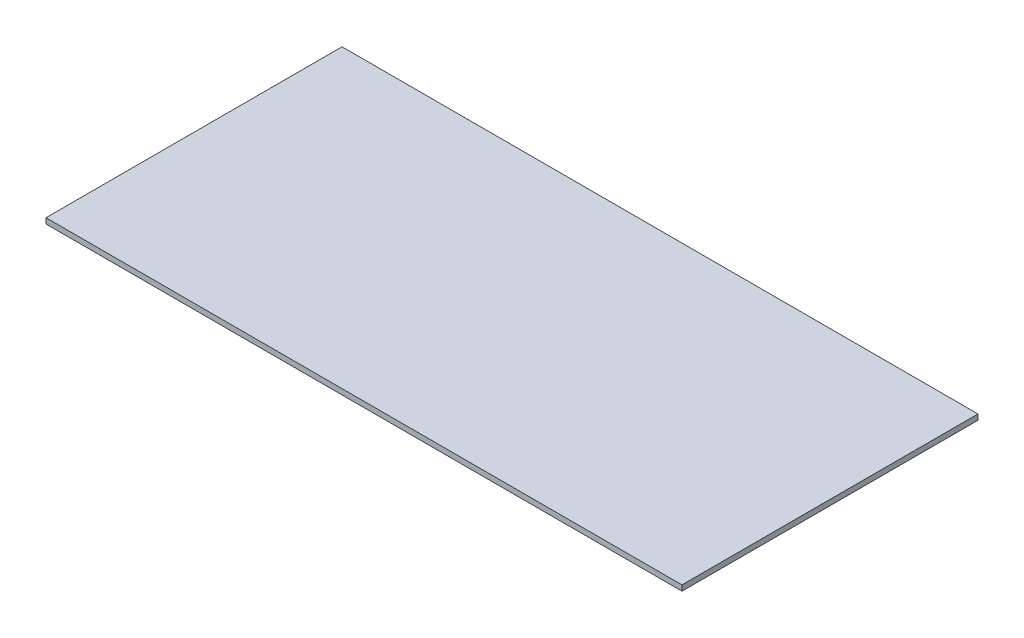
SolidWorks part; units mm, degrees
ref_plane "Ebene vorne" through (0, 0, 0) normal (0, 0, 1) x (1, 0, 0)
ref_plane "Ebene oben" through (0, 0, 0) normal (0, 1, 0) x (1, 0, 0)
ref_plane "Ebene rechts" through (0, 0, 0) normal (1, 0, 0) x (0, 0, -1)
sketch "Skizze1" plane through (0, 0, 0) normal (0, 1, 0) x (1, 0, 0)
  line L1 (-290, -135) -> (290, -135)
  line L2 (-290, -135) -> (-290, 135)
  line L3 (-290, 135) -> (290, 135)
  line L4 (290, -135) -> (290, 135)
  line L5 (-290, -135) -> (290, 135) construction
  line L6 (-290, 135) -> (290, -135) construction
  point P0 (0, 0)
  dimension "D1" = 580
  dimension "D2" = 270
extrude "Aufsatz-Linear austragen1" add sketch "Skizze1" along normal blind 5
